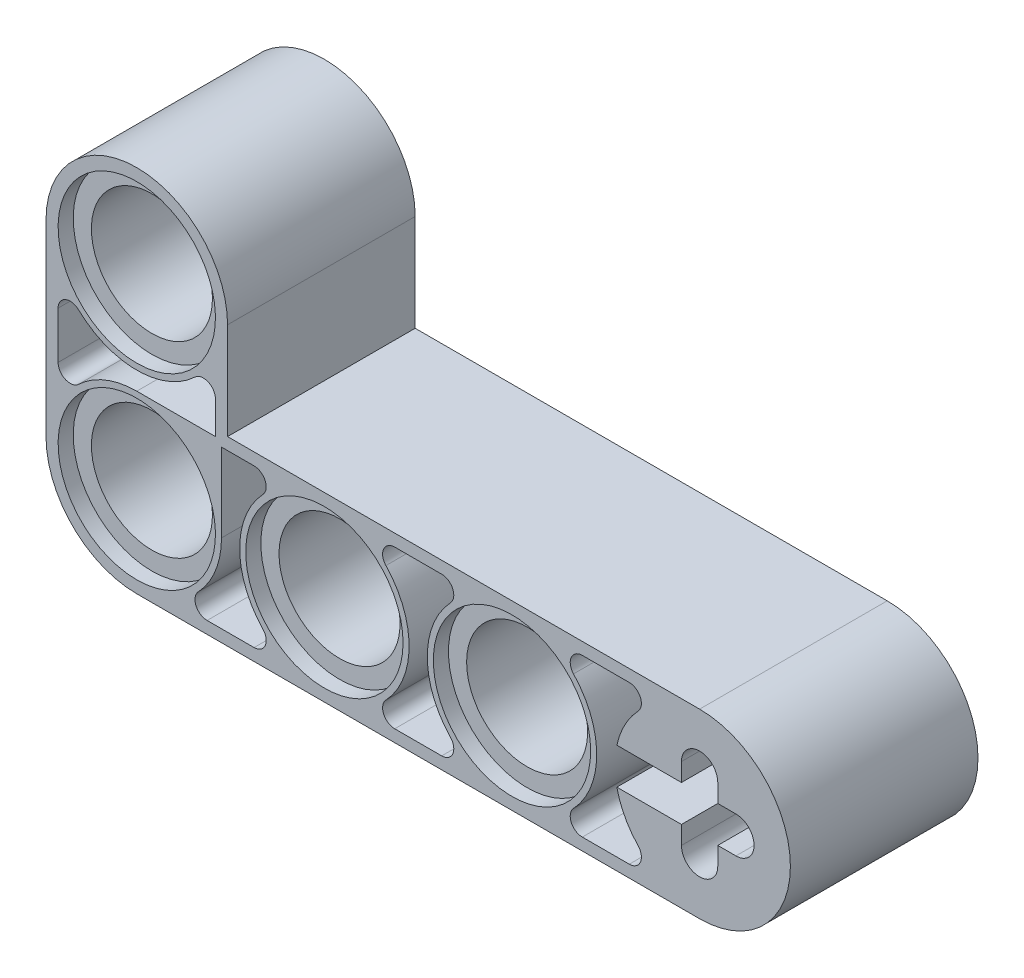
SolidWorks part; units mm, degrees
other "<LTemplate>-<Mirror1>"
other "<TwoStraight>-<Mirror3>"
ref_plane "Front Plane" through (0, 0, 0) normal (0, 0, 1) x (1, 0, 0)
ref_plane "Top Plane" through (0, 0, 0) normal (0, 1, 0) x (1, 0, 0)
ref_plane "Right Plane" through (0, 0, 0) normal (1, 0, 0) x (0, 0, -1)
ref_plane "Front Plane-LTemplate" through (7.6404, 8.2159, -6.6697) normal (0, 0, 1) x (1, 0, 0)
ref_plane "Top Plane-LTemplate" through (7.6404, 8.2159, -6.6697) normal (0, 1, 0) x (1, 0, 0)
ref_plane "Right Plane-LTemplate" through (7.6404, 8.2159, -6.6697) normal (1, 0, 0) x (0, 0, -1)
ref_plane "Plane2-LTemplate" through (19.3244, 8.2159, -6.6697) normal (1, 0, 0) x (0, 0, -1)
ref_plane "Plane3-LTemplate" through (7.6404, 8.2159, -6.6697) normal (0, 1, 0) x (-1, 0, 0)
inserted part "LTemplate"
move or copy body "Body-Move/Copy15" bodies to move or copy 102 copy yes number of copies 1 translate (0, 0, 0.254)
combine bodies "Combine1" operation type add bodies to combine 115 102
sketch "Sketch1" plane through (0, 0, -6.6697) normal (0, 0, -1) x (-1, 0, 0)
  line L0 (-7.6404, 8.2159) -> (0.2336, 8.2159) construction
  line L1 (0.2336, 8.2159) -> (8.1076, 8.2159) construction
  line L4 (8.1076, 12.0259) -> (0.2336, 12.0259)
  line L5 (8.1076, 4.4059) -> (0.2336, 4.4059)
  line L6 (8.1076, 8.2159) -> (15.9816, 8.2159) construction
  line L13 (0.2336, 11.5179) -> (0.2336, 12.0259)
  line L14 (0.2336, 4.4059) -> (0.2336, 4.9139)
  circle A0 centre (0.2336, 8.2159) radius 2.54 construction
  circle A1 centre (-7.6404, 8.2159) radius 2.54 construction
  circle A2 centre (0.2336, 8.2159) radius 2.54 construction
  circle A3 centre (-7.6404, 8.2159) radius 2.54 construction
  arc A4 (8.1076, 12.0259) -> (8.1076, 4.4059) centre (8.1076, 8.2159) ccw
  arc A6 (0.2336, 11.5179) -> (0.2336, 4.9139) centre (0.2336, 8.2159) cw
  dimension "D1" = 7.874
inserted part "TwoStraight"
extrude "Boss-Extrude1" add sketch "Sketch1" against normal blind 7.874
move or copy body "Body-Move/Copy18" bodies to move or copy 118 placed by mates yes
other "Angle3" parameters "D1"=90
combine bodies "Combine2" operation type add bodies to combine 119 122
sketch "Sketch4" plane through (0, 0, -6.6697) normal (0, 0, -1) x (-1, 0, 0)
  line L0 (-4.6892, 11.5179) -> (-2.7176, 11.5179) construction
  line L1 (-4.6892, 4.9139) -> (-2.7176, 4.9139) construction
  line L2 (-4.6892, 11.5179) -> (-2.7176, 11.5179) construction
  line L3 (-4.6892, 4.9139) -> (-2.7176, 4.9139) construction
  line L4 (3.1848, 4.9139) -> (5.1564, 4.9139)
  line L5 (3.1848, 11.5179) -> (4.5516, 11.5179)
  line L6 (4.5516, 8.2159) -> (4.5516, 11.5179)
  arc A0 (-4.6892, 11.5179) -> (-5.0581, 10.6607) centre (-4.6892, 11.0099) ccw construction
  arc A1 (-5.0581, 5.7712) -> (-5.0581, 10.6607) centre (-7.6404, 8.2159) ccw construction
  arc A2 (-5.0581, 5.7712) -> (-4.6892, 4.9139) centre (-4.6892, 5.4219) ccw construction
  arc A3 (-2.7176, 4.9139) -> (-2.3487, 5.7712) centre (-2.7176, 5.4219) ccw construction
  arc A4 (-2.3487, 10.6607) -> (-2.3487, 5.7712) centre (0.2336, 8.2159) ccw construction
  arc A5 (-2.3487, 10.6607) -> (-2.7176, 11.5179) centre (-2.7176, 11.0099) ccw construction
  arc A6 (-4.6892, 11.5179) -> (-5.0581, 10.6607) centre (-4.6892, 11.0099) ccw construction
  arc A7 (-5.0581, 5.7712) -> (-5.0581, 10.6607) centre (-7.6404, 8.2159) ccw construction
  arc A8 (-5.0581, 5.7712) -> (-4.6892, 4.9139) centre (-4.6892, 5.4219) ccw construction
  arc A9 (-2.7176, 4.9139) -> (-2.3487, 5.7712) centre (-2.7176, 5.4219) ccw construction
  arc A10 (-2.3487, 10.6607) -> (-2.3487, 5.7712) centre (0.2336, 8.2159) ccw construction
  arc A11 (-2.3487, 10.6607) -> (-2.7176, 11.5179) centre (-2.7176, 11.0099) ccw construction
  arc A12 (5.1564, 4.9139) -> (5.5253, 5.7712) centre (5.1564, 5.4219) ccw
  arc A13 (4.5516, 8.2159) -> (5.5253, 5.7712) centre (8.1076, 8.2159) ccw
  arc A15 (3.1848, 11.5179) -> (2.8159, 10.6607) centre (3.1848, 11.0099) ccw
  arc A16 (2.8159, 5.7712) -> (2.8159, 10.6607) centre (0.2336, 8.2159) ccw
  arc A17 (2.8159, 5.7712) -> (3.1848, 4.9139) centre (3.1848, 5.4219) ccw
  arc A18 (5.5253, 10.6607) -> (5.1564, 11.5179) centre (5.1564, 11.0099) ccw
  dimension "D1" = 2
extrude "Cut-Extrude3" cut sketch "Sketch4" against normal blind 7.874
sketch "Sketch6" plane through (0, 0, -6.6697) normal (0, 0, -1) x (-1, 0, 0)
  line L0 (11.4096, 13.1387) -> (11.4096, 11.1671) construction
  line L1 (4.8056, 13.1387) -> (4.8056, 12.0259) construction
  line L2 (11.4096, 13.1387) -> (11.4096, 11.1671)
  line L3 (4.8056, 13.1387) -> (4.8056, 11.7719)
  line L4 (8.1076, 11.7719) -> (4.8056, 11.7719)
  arc A0 (11.4096, 13.1387) -> (10.5524, 13.5076) centre (10.9016, 13.1387) ccw construction
  arc A1 (5.6629, 13.5076) -> (10.5524, 13.5076) centre (8.1076, 16.0899) ccw construction
  arc A2 (5.6629, 13.5076) -> (4.8056, 13.1387) centre (5.3136, 13.1387) ccw construction
  arc A4 (10.5524, 10.7982) -> (5.6629, 10.7982) centre (8.1076, 8.2159) ccw construction
  arc A5 (10.5524, 10.7982) -> (11.4096, 11.1671) centre (10.9016, 11.1671) ccw construction
  arc A6 (11.4096, 13.1387) -> (10.5524, 13.5076) centre (10.9016, 13.1387) ccw
  arc A7 (5.6629, 13.5076) -> (10.5524, 13.5076) centre (8.1076, 16.0899) ccw
  arc A8 (5.6629, 13.5076) -> (4.8056, 13.1387) centre (5.3136, 13.1387) ccw
  arc A10 (10.5524, 10.7982) -> (8.1076, 11.7719) centre (8.1076, 8.2159) ccw
  arc A11 (10.5524, 10.7982) -> (11.4096, 11.1671) centre (10.9016, 11.1671) ccw
extrude "Cut-Extrude5" cut sketch "Sketch6" against normal blind 7.874
sketch "Sketch8" plane through (0, 0, -6.6697) normal (0, 0, -1) x (-1, 0, 0)
  line L0 (4.8056, 11.7719) -> (8.1076, 11.7719)
  line L1 (4.8056, 11.7719) -> (4.8019, 9.5264)
  arc A0 (10.5524, 10.7982) -> (5.6629, 10.7982) centre (8.1076, 8.2159) ccw construction
  arc A1 (8.1076, 11.7719) -> (4.8019, 9.5264) centre (8.1076, 8.2159) ccw
extrude "Boss-Extrude3" add sketch "Sketch8" against normal blind 7.874
sketch "Sketch7" plane through (0, 0, -0.2821) normal (0, 0, -1) x (-1, 0, 0)
  line L1 (12.6796, 11.7719) -> (12.6796, 11.1671)
  line L2 (15.9816, 11.7719) -> (12.6796, 11.7719)
  arc A4 (12.6796, 11.1671) -> (13.5369, 10.7982) centre (13.1876, 11.1671) ccw
  arc A5 (15.9816, 11.7719) -> (13.5369, 10.7982) centre (15.9816, 8.2159) ccw
